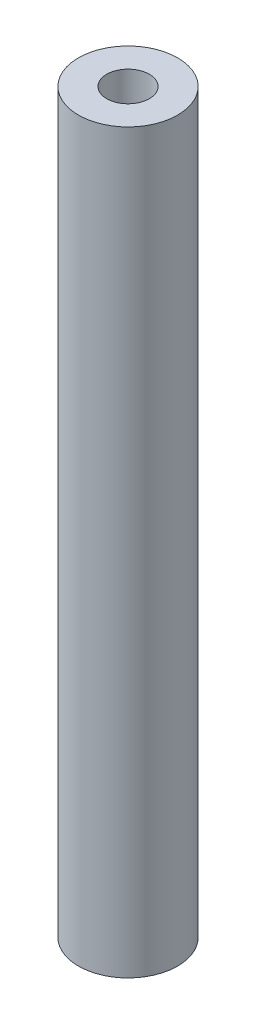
SolidWorks part; units mm, degrees
ref_plane "Front Plane" through (0, 0, 0) normal (0, 0, 1) x (1, 0, 0)
ref_plane "Top Plane" through (0, 0, 0) normal (0, 1, 0) x (1, 0, 0)
ref_plane "Right Plane" through (0, 0, 0) normal (1, 0, 0) x (0, 0, -1)
sketch "Sketch1" plane through (0, 0, 0) normal (0, 1, 0) x (1, 0, 0)
  circle A0 centre (0, 0) radius 1.5
  circle A1 centre (0, 0) radius 3.5
  dimension "D1" = 3
  dimension "D2" = 2
extrude "Boss-Extrude1" add sketch "Sketch1" along normal blind 52
